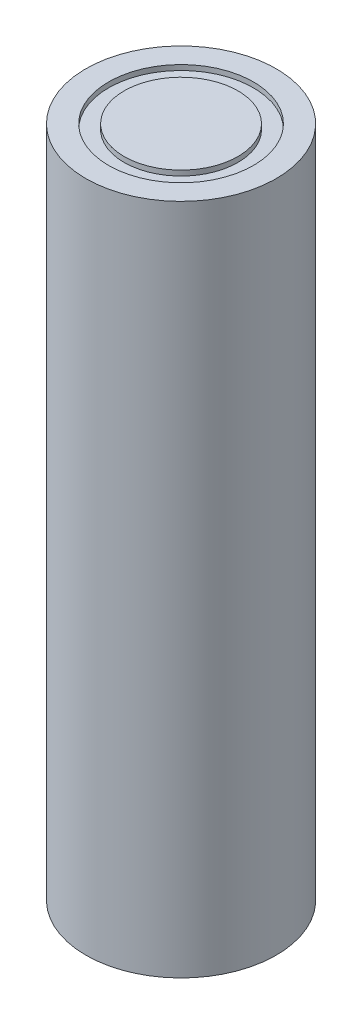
SolidWorks part; units mm, degrees
ref_plane "Plan de face" through (0, 0, 0) normal (0, 0, 1) x (1, 0, 0)
ref_plane "Plan de dessus" through (0, 0, 0) normal (0, 1, 0) x (1, 0, 0)
ref_plane "Plan de droite" through (0, 0, 0) normal (1, 0, 0) x (0, 0, -1)
sketch "Esquisse1" plane through (0, 0, 0) normal (0, 0, 1) x (1, 0, 0)
  line L0 (0, 32.5) -> (5.5, 32.5)
  line L1 (5.5, 32.5) -> (5.5, 32)
  line L2 (5.5, 32) -> (7, 32)
  line L3 (7, 32) -> (7, 32.5)
  line L4 (7, 32.5) -> (9.2, 32.5)
  line L5 (9.2, 32.5) -> (9.2, -32.5)
  line L6 (9.2, -32.5) -> (7.4, -32.5)
  line L7 (7.4, -32.3) -> (7.2, -32.3)
  line L8 (7.2, -32.3) -> (7.2, -32.5)
  line L9 (7.2, -32.5) -> (0, -32.5)
  line L10 (0, -32.5) -> (0, 32.5)
  line L11 (7.4, -32.3) -> (7.4, -32.5)
  line L12 (0, -32.5) -> (0, -41.4882) construction
  point P2 (6.8, 32)
  point P15 (0, -41.4882)
  dimension "D1" = 18.4
  dimension "D2" = 65
  dimension "D3" = 1.5
  dimension "D4" = 0.5
  dimension "D5" = 2.2
  dimension "D6" = 1.8
  dimension "D7" = 0.2
  dimension "D8" = 0.2
revolve "Révolution1" add sketch "Esquisse1" angle 360 about L12
